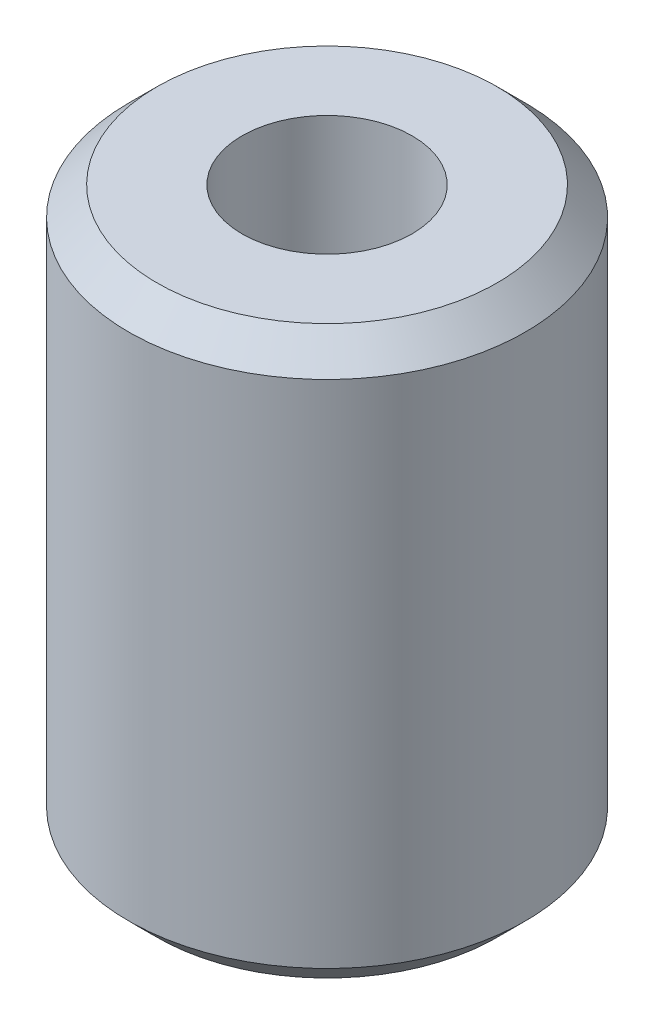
SolidWorks part; units mm, degrees
ref_plane "Front Plane" through (0, 0, 0) normal (0, 0, 1) x (1, 0, 0)
ref_plane "Top Plane" through (0, 0, 0) normal (0, 1, 0) x (1, 0, 0)
ref_plane "Right Plane" through (0, 0, 0) normal (1, 0, 0) x (0, 0, -1)
sketch "Sketch1" plane through (0, 0, 0) normal (0, 0, 1) x (1, 0, 0)
  line L0 (0, 5) -> (0, 0) construction
  line L1 (0, 0) -> (0, -5) construction
  line L2 (0, 5) -> (1.5, 5) construction
  line L3 (0, -5) -> (1.5, -5) construction
  line L4 (1.5, -5) -> (1.5, 5)
  line L5 (1.5, 5) -> (3, 5)
  line L6 (3, 5) -> (3.5, 4.5)
  line L7 (3.5, -4.5) -> (3.5, 4.5)
  line L11 (3.5, -4.5) -> (3, -4.5) construction
  line L12 (3, -4.5) -> (3, -5) construction
  line L14 (3.5, -4.5) -> (3, -5)
  line L15 (3, -5) -> (1.5, -5)
  line L16 (3.5, 4.5) -> (3, 4.5) construction
  line L17 (3, 4.5) -> (3, 5) construction
  line L18 (3, -4.5) -> (3, 4.5) construction
  line L22 (0, 0) -> (3.5, 0) construction
  dimension "Total_length" = 10
  dimension "Inside_diameter" = 3
  dimension "D4" = 0.5
  dimension "Diameter_outside" = 7
revolve "Revolve1" add sketch "Sketch1" angle 360 about L0
